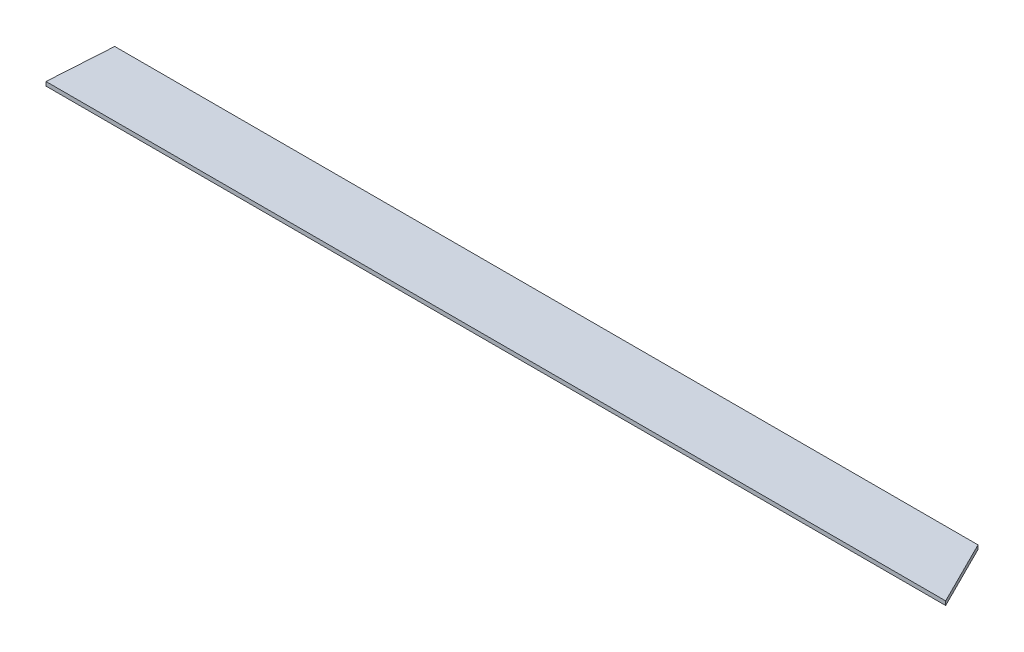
SolidWorks part; units mm, degrees
ref_plane "FRONT" through (0, 0, 0) normal (0, 0, 1) x (1, 0, 0)
ref_plane "TOP" through (0, 0, 0) normal (0, 1, 0) x (1, 0, 0)
ref_plane "RIGHT" through (0, 0, 0) normal (1, 0, 0) x (0, 0, -1)
sketch "Sketch1" plane through (0, 0, 0) normal (0, 1, 0) x (1, 0, 0)
  line L0 (-695.0956, -51.8486) -> (-695.0956, -226.1108) construction
  line L1 (-688.7456, 49.7514) -> (666.9794, 49.7514)
  line L2 (-688.7456, 49.7514) -> (-695.0956, -51.8486)
  line L3 (-695.0956, -51.8486) -> (717.7794, -51.8486)
  line L4 (666.9794, 49.7514) -> (717.7794, -51.8486)
  line L5 (-688.7456, 49.7514) -> (717.7794, -51.8486) construction
  line L6 (-695.0956, -51.8486) -> (666.9794, 49.7514) construction
  line L7 (717.7794, -51.8486) -> (717.7794, -204.6442) construction
  point P0 (0, 0)
  dimension "D1" = 101.6
  dimension "D2" = 1412.875
  dimension "D3" = 6.35
  dimension "D4" = 50.8
extrude "Boss-Extrude1" add sketch "Sketch1" along normal blind 6.35
